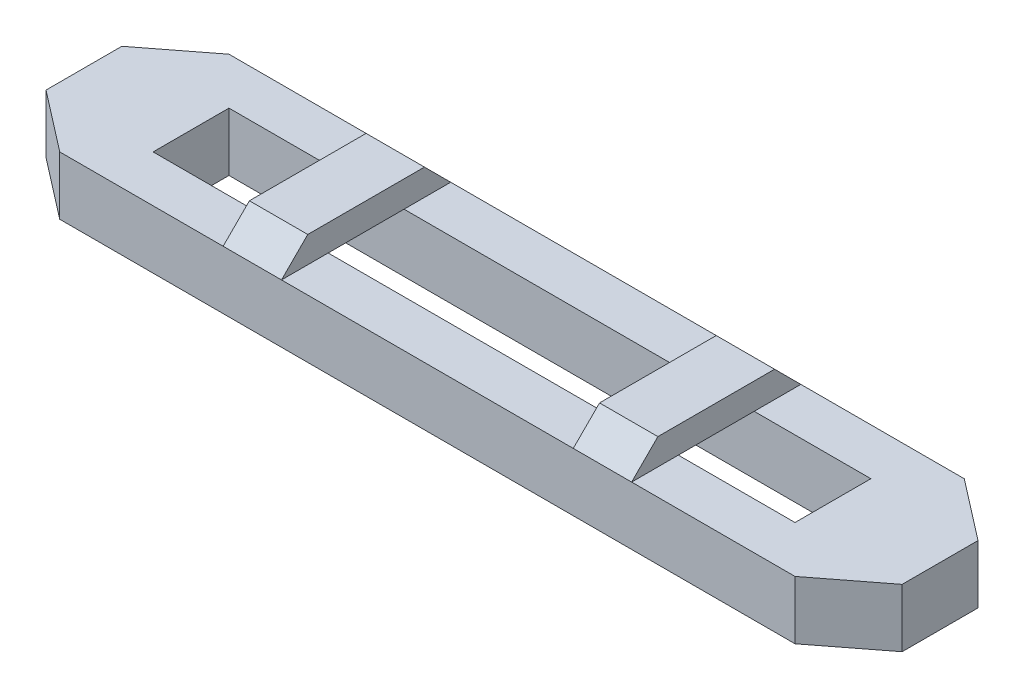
SolidWorks part; units mm, degrees
ref_plane "Alzado" through (0, 0, 0) normal (0, 0, 1) x (1, 0, 0)
ref_plane "Planta" through (0, 0, 0) normal (0, 1, 0) x (1, 0, 0)
ref_plane "Vista lateral" through (0, 0, 0) normal (1, 0, 0) x (0, 0, -1)
sketch "Croquis1" plane through (0, 0, 0) normal (0, 1, 0) x (1, 0, 0)
  line L0 (-55, 6.5) -> (55, -6.5) construction
  line L1 (-55, 6.5) -> (55, 6.5)
  line L2 (-55, 6.5) -> (-55, -6.5)
  line L3 (-55, -6.5) -> (55, -6.5)
  line L4 (55, 6.5) -> (55, -6.5)
  line L5 (-63, 14.5) -> (63, 14.5)
  line L6 (-55, 6.5) -> (-55, -6.5) construction
  line L7 (-63, -14.5) -> (63, -14.5)
  line L8 (0, 38.4134) -> (0, -37.0114) construction
  line L9 (-63, 14.5) -> (-73.356, 6.5)
  line L10 (-73.356, 6.5) -> (-73.356, -6.5)
  line L11 (63, -14.5) -> (73.356, -6.5)
  line L12 (-63, -14.5) -> (-73.356, -6.5)
  line L13 (-63, 14.5) -> (-63, -14.5) construction
  line L14 (73.356, 6.5) -> (73.356, -6.5)
  line L15 (63, 14.5) -> (73.356, 6.5)
  line L16 (63, 14.5) -> (63, -14.5) construction
  line L17 (-55, 6.5) -> (55, 6.5) construction
  line L18 (-55, -6.5) -> (55, -6.5) construction
  line L19 (55, 6.5) -> (55, -6.5) construction
  point P14 (-73.356, 0)
  dimension "D1" = 110
  dimension "D2" = 8
extrude "Extruir1" add sketch "Croquis1" along normal blind 10
ref_plane "Plano1" through (30, 0, 0) normal (1, 0, 0) x (0, 0, -1)
sketch "Croquis4" plane through (30, 0, 0) normal (1, 0, 0) x (0, 0, -1)
  line L0 (-14.5, 10) -> (14.5, 10)
  line L1 (14.5, 10) -> (10, 14.5)
  line L2 (10, 14.5) -> (-10, 14.5)
  line L3 (-10, 14.5) -> (-14.5, 10)
  dimension "D1" = 45
  dimension "D2" = 45
  dimension "D3" = 20
extrude "Extruir3" add sketch "Croquis4" along normal mid plane 10
mirror "Simetría1" about plane through (0, 0, 0) normal (1, 0, 0) of "Extruir3"
